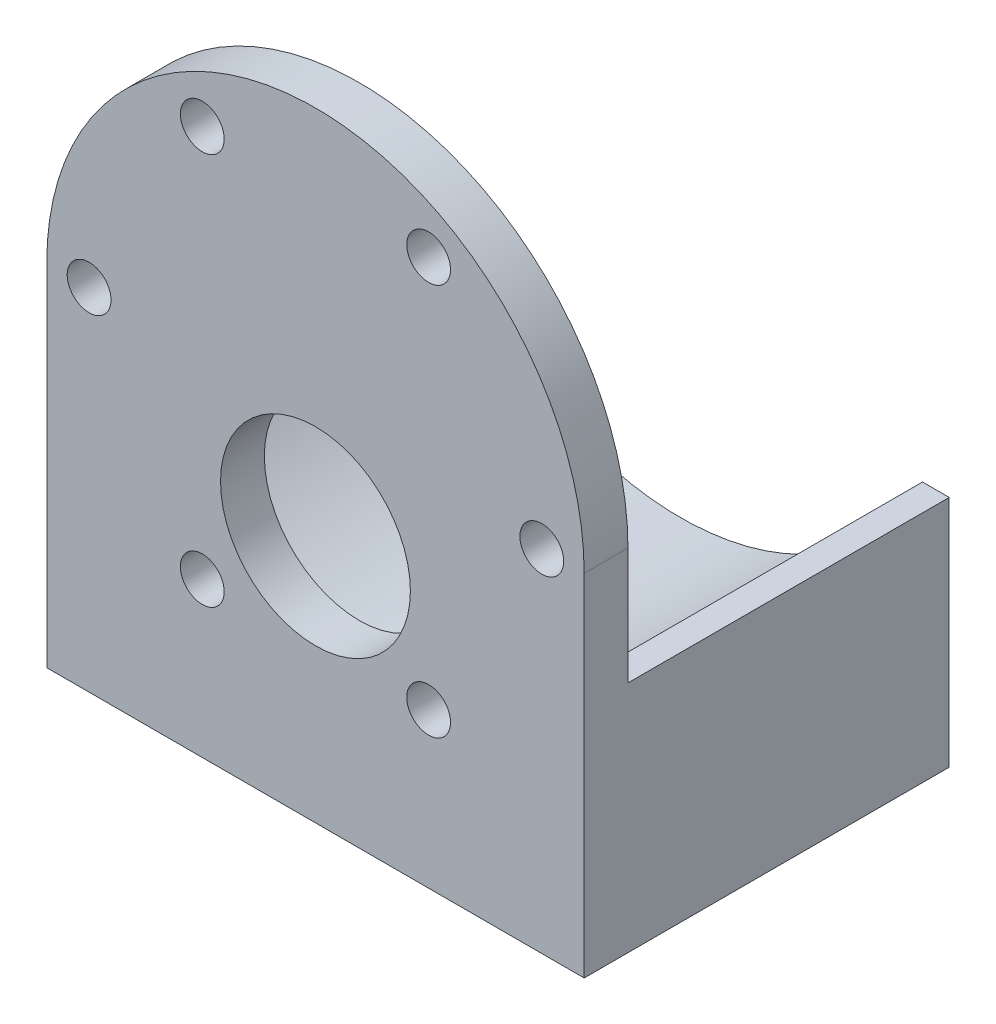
SolidWorks part; units mm, degrees
ref_plane "Front Plane" through (0, 0, 0) normal (0, 0, 1) x (1, 0, 0)
ref_plane "Top Plane" through (0, 0, 0) normal (0, 1, 0) x (1, 0, 0)
ref_plane "Right Plane" through (0, 0, 0) normal (1, 0, 0) x (0, 0, -1)
sketch "Sketch1" plane through (0, 0, 0) normal (0, 0, 1) x (1, 0, 0)
  line L0 (-15.5, 0) -> (15.5, 0) construction
  circle A0 centre (0, 0) radius 18.4
  circle A1 centre (7.75, 13.4234) radius 1.5
  circle A2 centre (-7.75, 13.4234) radius 1.5
  circle A3 centre (-15.5, 0) radius 1.5
  circle A4 centre (15.5, 0) radius 1.5
  circle A5 centre (-7.75, -13.4234) radius 1.5
  circle A6 centre (7.75, -13.4234) radius 1.5
  point P15 (0, 0)
  dimension "D1" = 36.8
  dimension "D7" = 3
  dimension "D2" = 15.5
  dimension "D3" = 31
  dimension "D4" = 15.5
  dimension "D5" = 15.5
  dimension "D6" = 31
extrude "Boss-Extrude1" add sketch "Sketch1" along normal blind 3
sketch "Sketch2" plane through (0, 0, 3) normal (0, 0, 1) x (1, 0, 0)
  circle A0 centre (0, -7) radius 6.5
  dimension "D1" = 13
  dimension "D2" = 7
extrude "Cut-Extrude1" cut sketch "Sketch2" against normal blind 3
sketch "Sketch3" plane through (0, 0, 3) normal (0, 0, 1) x (1, 0, 0)
  line L0 (-18.4, 0) -> (-18.4, -24)
  line L1 (-18.4, -24) -> (18.4, -24)
  line L2 (18.4, -24) -> (18.4, 0)
  circle A0 centre (0, 0) radius 18.4 construction
  circle A2 centre (0, 0) radius 18.4
  arc A3 (-18.4, 0) -> (18.4, 0) centre (0, 0) ccw
  dimension "D2" = 24
  dimension "D1" = 0
extrude "Boss-Extrude3" add sketch "Sketch3" against normal blind 5
sketch "Sketch4" plane through (18.4, 0, 0) normal (1, 0, 0) x (0, 0, -1)
  line L0 (2, -24) -> (2, 0) construction
  line L1 (0, 0) -> (2, 0)
  line L2 (0, 0) -> (0, -8)
  line L3 (0, -8) -> (2, -8)
  line L4 (2, 0) -> (2, -8)
  dimension "D1" = 8
extrude "Cut-Extrude2" cut sketch "Sketch4" against normal blind 62
sketch "Sketch5" plane through (0, 0, -2) normal (0, 0, -1) x (-1, 0, 0)
  line L5 (-18.4, -24) -> (-18.4, -8)
  line L6 (-18.4, -8) -> (-16.5699, -8)
  line L7 (16.5699, -8) -> (18.4, -8)
  line L8 (18.4, -8) -> (18.4, -24)
  line L9 (18.4, -24) -> (-18.4, -24)
  arc A0 (-16.5699, -8) -> (16.5699, -8) centre (0, 0) ccw
  arc A1 (-16.5699, -8) -> (16.5699, -8) centre (0, 0) ccw construction
extrude "Boss-Extrude4" add sketch "Sketch5" along normal blind 20
